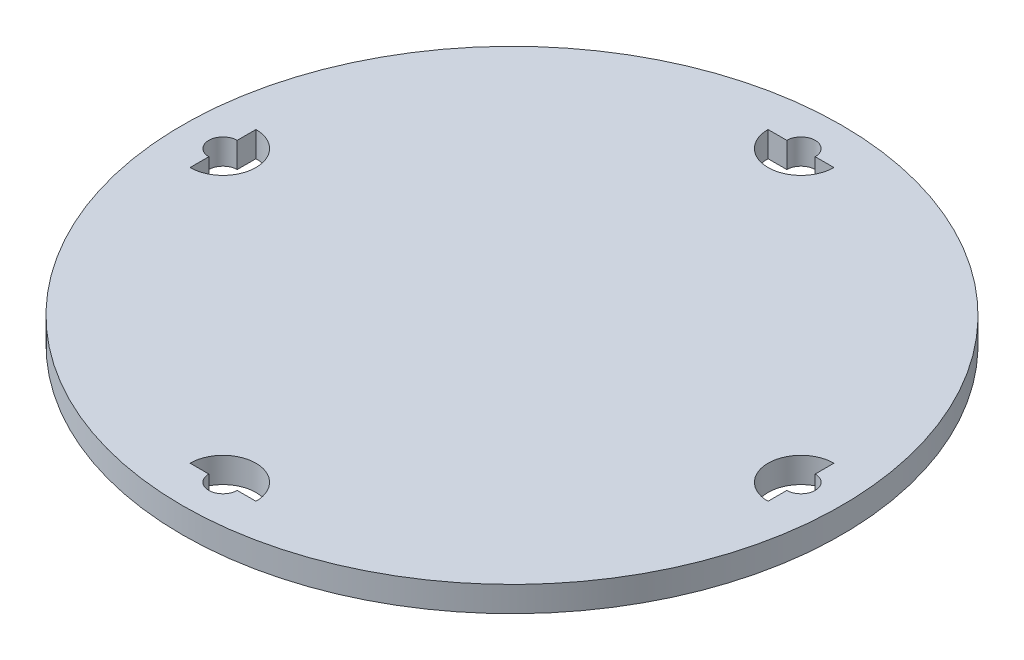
SolidWorks part; units mm, degrees
ref_plane "Front Plane" through (0, 0, 0) normal (0, 0, 1) x (1, 0, 0)
ref_plane "Top Plane" through (0, 0, 0) normal (0, 1, 0) x (1, 0, 0)
ref_plane "Right Plane" through (0, 0, 0) normal (1, 0, 0) x (0, 0, -1)
sketch "Sketch3" plane through (0, 0, 0) normal (0, 1, 0) x (1, 0, 0)
  circle A0 centre (0, 0) radius 82.55
  dimension "D1" = 165.1
extrude "Boss-Extrude1" add sketch "Sketch3" along normal blind 6.35
sketch "Sketch4" plane through (0, 0, 0) normal (0, 1, 0) x (1, 0, 0)
  line L0 (-86.5065, -82.55) -> (-83.1461, -82.55) construction
  line L1 (-3.556, -72.39) -> (-8.255, -72.39)
  line L2 (3.556, -72.39) -> (8.255, -72.39)
  circle A0 centre (0, -72.39) radius 3.556
  circle A1 centre (0, 0) radius 82.55 construction
  arc A2 (-8.255, -72.39) -> (8.255, -72.39) centre (0, -72.39) cw
  dimension "D1" = 7.112
  dimension "D3" = 8.255
  dimension "D2" = 10.16
extrude "Cut-Extrude1" cut sketch "Sketch4" along normal up to next contours A2 L1 A0 L2 | A0
pattern_circular "CirPattern1" count 4 over 360 about axis through (0, 0, 0) along (0, 1, 0) of "Cut-Extrude1"
